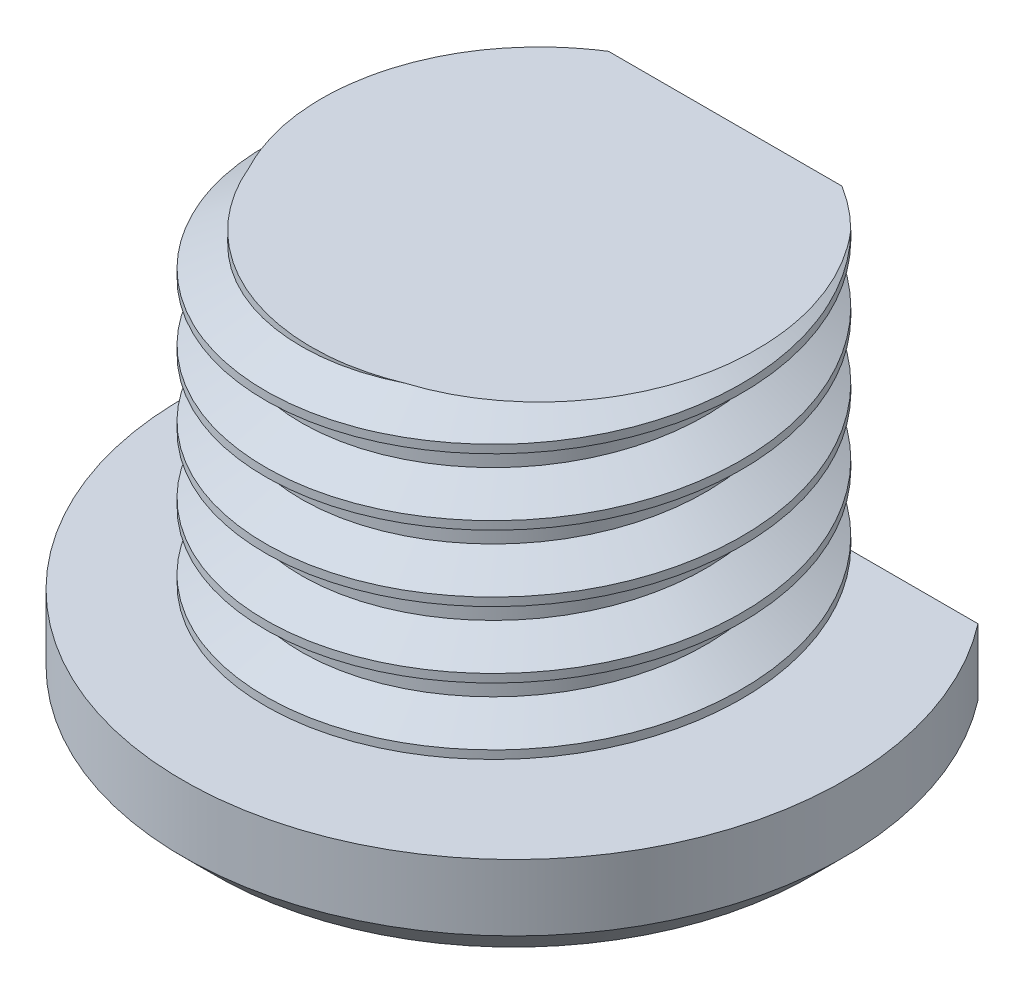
SolidWorks part; units mm, degrees
ref_plane "Front Plane" through (0, 0, 0) normal (0, 0, 1) x (1, 0, 0)
ref_plane "Top Plane" through (0, 0, 0) normal (0, 1, 0) x (1, 0, 0)
ref_plane "Right Plane" through (0, 0, 0) normal (1, 0, 0) x (0, 0, -1)
sketch "Sketch1" plane through (0, 0, 0) normal (0, 1, 0) x (1, 0, 0)
  circle A0 centre (0, 0) radius 4.572
  dimension "D1" = 9.144
extrude "Boss-Extrude1" add sketch "Sketch1" along normal blind 5.969
thread "Thread1" pitch 1.27 start angle 180, offset 1.27, length 7.62, pitch 1.27, diameter 9.144
ref_plane "Plane1" through (4.572, 7.239, 0) normal (0, 0, -1) x (1, 0, 0)
sketch "Thread Profile1" plane through (4.572, 7.239, 0) normal (0, 0, -1) x (1, 0, 0)
  line L0 (0, 0) -> (0, 1.27) construction
  line L11 (0, 0) -> (0, 1.1112)
  line L12 (0, 1.1112) -> (-0.6874, 0.7144)
  line L13 (-0.6874, 0.7144) -> (-0.6874, 0.3969)
  line L15 (-0.6874, 0.3969) -> (0, 0)
  line L17 (-0.6874, 0.5556) -> (0, 0.5556) construction
  point P2 (0, 0)
  dimension "Pitch" = 1.27
  dimension "Profile_Angle" = 60
  dimension "Profile_Land" = 0.3175
  dimension "Profile_Height" = 0.6874
sketch "Sketch5" plane through (0, 0, 0) normal (0, -1, 0) x (1, 0, 0)
  circle A0 centre (0, 0) radius 6.35
  dimension "D1" = 12.7
extrude "Boss-Extrude2" add sketch "Sketch5" along normal blind 1.905
chamfer "Chamfer1" distance 0.635 angle 45 1 edges at (0, -1.905, -6.35)
sketch "Sketch6" plane through (0, -1.905, 0) normal (0, -1, 0) x (1, 0, 0)
  line L0 (-2.032, 0) -> (2.032, 0) construction
  line L1 (-2.032, 0.508) -> (2.032, 0.508)
  line L2 (-2.032, -0.508) -> (2.032, -0.508)
  arc A0 (-2.032, 0.508) -> (-2.032, -0.508) centre (-2.032, 0) ccw
  arc A1 (2.032, -0.508) -> (2.032, 0.508) centre (2.032, 0) ccw
  point P2 (0, 0)
  dimension "D1" = 4.064
  dimension "D2" = 1.016
extrude "Cut-Extrude1" cut sketch "Sketch6" against normal blind 3.81
sketch "Sketch7" plane through (0, -1.905, 0) normal (0, -1, 0) x (1, 0, 0)
  line L0 (3.8837, -5.0239) -> (3.8837, 5.0239)
  circle A0 centre (0, 0) radius 3.8837 construction
  circle A1 centre (0, 0) radius 6.35 construction
  arc A2 (3.8837, -5.0239) -> (3.8837, 5.0239) centre (0, 0) ccw
  circle A3 centre (0, 0) radius 4.572 construction
  point P8 (3.8837, 0)
  dimension "D1" = 7.7673
  dimension "D2" = 9.144
extrude "Cut-Extrude2" cut sketch "Sketch7" against normal through all both and the other way through all
move or copy body "Body-Move/Copy1" bodies to move or copy 105 copy no rotation origin (0, 0, 0) rotation axis (0, 1, 0) rotation angle 90
